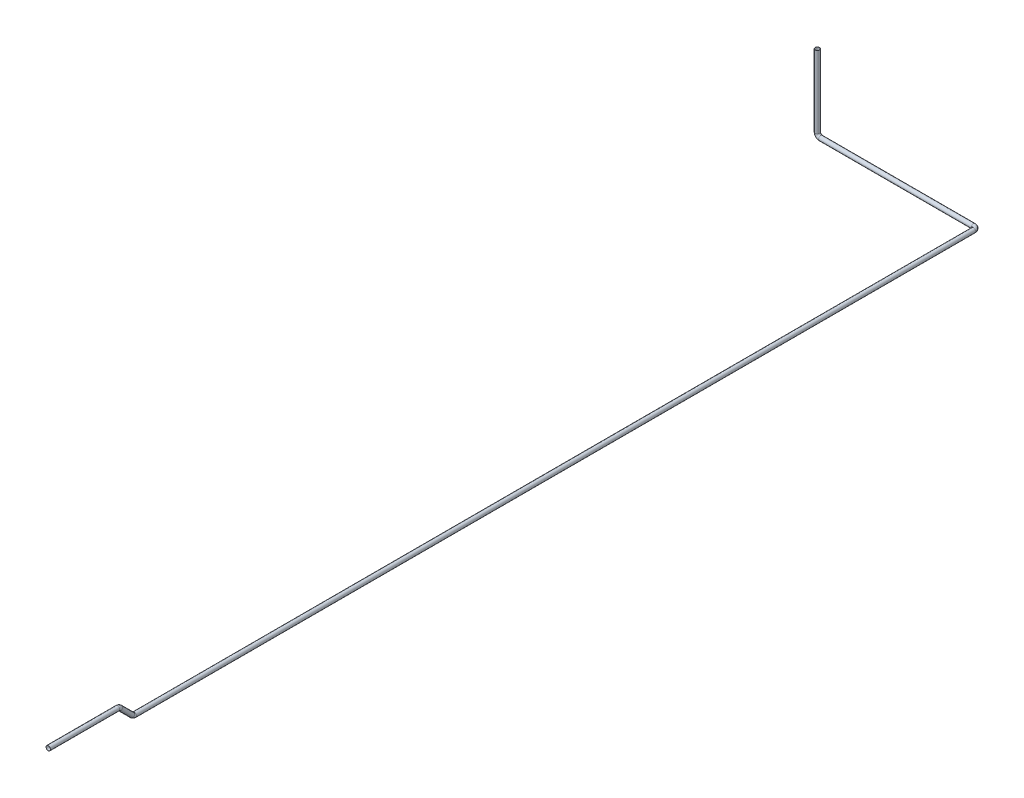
SolidWorks part; units mm, degrees
ref_plane "Alzado" through (0, 0, 0) normal (0, 0, 1) x (1, 0, 0)
ref_plane "Planta" through (0, 0, 0) normal (0, 1, 0) x (1, 0, 0)
ref_plane "Vista lateral" through (0, 0, 0) normal (1, 0, 0) x (0, 0, -1)
sketch3d "Croquis3D1"
  line L0 (0, 0, 0) -> (0, -1030, 0)
  line L1 (50, -1080, 0) -> (2230, -1080, 0)
  line L2 (2280, -1080, 50) -> (2280, -1080, 12039.2893)
  line L3 (2280, -1065.3553, 12074.6447) -> (2280, -894.6447, 12245.3553)
  line L4 (2280, -880, 12280.7107) -> (2280, -880, 13270)
  arc A0 (2280, -894.6447, 12245.3553) -> (2280, -880, 12280.7107) centre (2280, -930, 12280.7107) ccw
  arc A1 (2280, -1080, 12039.2893) -> (2280, -1065.3553, 12074.6447) centre (2280, -1030, 12039.2893) ccw
  arc A2 (2230, -1080, 0) -> (2280, -1080, 50) centre (2230, -1080, 50) ccw
  arc A3 (0, -1030, 0) -> (50, -1080, 0) centre (50, -1030, 0) ccw
  point P9 (2280, -880, 12260)
  point P10 (2330, -930, 12280.7107)
  point P13 (2280, -1080, 12060)
  point P14 (2230, -1030, 12039.2893)
  point P17 (2280, -1080, 0)
  point P18 (2230, -1130, 50)
  point P21 (0, -1080, 0)
  point P22 (50, -1030, 50)
  dimension "D8" = 50
  dimension "D1" = 1080
  dimension "D2" = 2280
  dimension "D3" = 12060
  dimension "D4" = 135
  dimension "D5" = 200
  dimension "D6" = 1010
sketch "Croquis2" plane through (0, 0, 0) normal (0, 1, 0) x (1, 0, 0)
  circle A0 centre (0, 0) radius 31.75
  circle A1 centre (0, 0) radius 30
  dimension "D1" = 63.5
  dimension "D2" = 60
sweep "Barrer1" add profiles "Croquis2" path "Croquis3D1"
